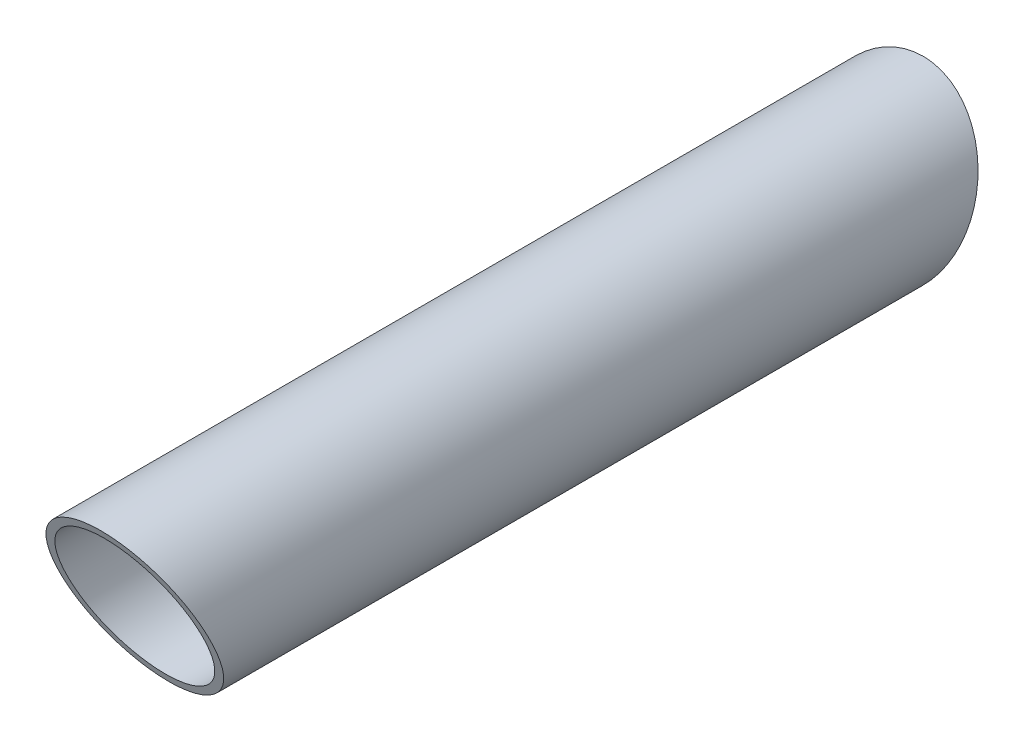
SolidWorks part; units mm, degrees
ref_plane "Ebene1" through (0, 0, 0) normal (0, 0, 1) x (1, 0, 0)
ref_plane "Ebene2" through (0, 0, 0) normal (0, 1, 0) x (1, 0, 0)
ref_plane "Ebene3" through (0, 0, 0) normal (1, 0, 0) x (0, 0, -1)
sketch "Skizze1" plane through (0, 0, 0) normal (0, 0, 1) x (1, 0, 0)
  circle A0 centre (0, 0) radius 18
  circle A1 centre (0, 0) radius 20
  dimension "D1" = 40
  dimension "D2" = 2
extrude "Aufsatz-Linear austragen1" add sketch "Skizze1" along normal mid plane 200
sketch "Skizze2" plane through (0, 0, 0) normal (1, 0, 0) x (0, 0, -1)
  line L0 (-100, 20) -> (-100, -20)
  line L1 (-100, 20) -> (-100, -20) construction
  line L2 (-100, -20) -> (-83.5132, -20)
  line L3 (-100, -20) -> (100, -20) construction
  line L4 (-83.5132, -20) -> (-100, 20)
  line L5 (0, 20) -> (0, -20) construction
  line L6 (100, 20) -> (-100, 20) construction
  line L7 (83.5132, -20) -> (100, 20)
  line L8 (100, -20) -> (83.5132, -20)
  line L9 (100, 20) -> (100, -20)
  dimension "D1" = 22.4
extrude "Schnitt-Linear austragen1" cut sketch "Skizze2" against normal mid plane 40
sketch "Skizze3" plane through (0, -32.3274, 78.4322) normal (0, -0.3811, 0.9245) x (1, 0, 0)
  line L0 (-20, 34.9657) -> (20, 34.9657) construction
sketch "Skizze4" plane through (0, -32.3274, -78.4322) normal (0, -0.3811, -0.9245) x (-1, 0, 0)
  line L0 (-20, 34.9657) -> (20, 34.9657) construction
